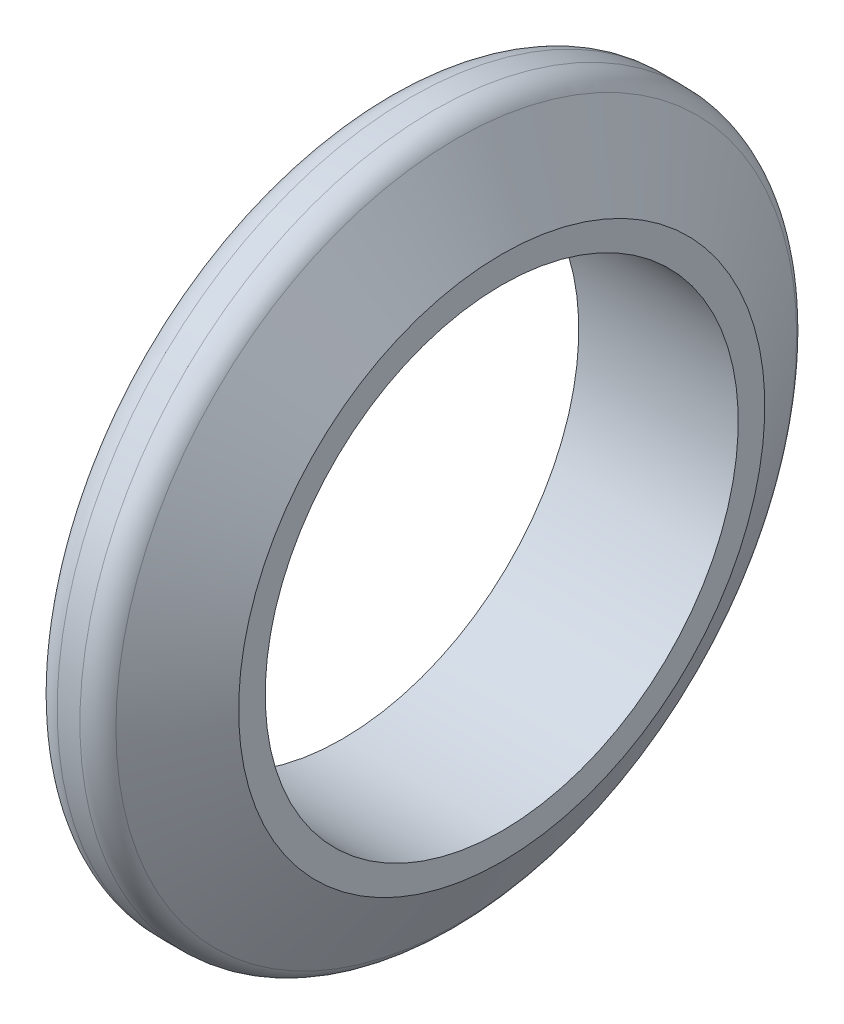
SolidWorks part; units mm, degrees
ref_plane "Front" through (0, 0, 0) normal (0, 0, 1) x (1, 0, 0)
ref_plane "Top" through (0, 0, 0) normal (0, 1, 0) x (1, 0, 0)
ref_plane "Right" through (0, 0, 0) normal (1, 0, 0) x (0, 0, -1)
sketch "Esquisse1" plane through (0, 0, 0) normal (0, 0, 1) x (1, 0, 0)
  line L0 (-62.6155, 0) -> (54.2158, 0) construction
  line L1 (0, 0) -> (-30, 0)
  line L2 (0, 0) -> (0, 49.5)
  line L3 (-12.8597, 66.5) -> (-17.1403, 66.5)
  line L4 (-30, 0) -> (-30, 49.5)
  line L6 (-21.4499, 64.0351) -> (-30, 49.5)
  line L7 (0, 49.5) -> (-8.5501, 64.0351)
  arc A0 (-17.1403, 66.5) -> (-21.4499, 64.0351) centre (-17.1403, 61.5) ccw
  arc A1 (-8.5501, 64.0351) -> (-12.8597, 66.5) centre (-12.8597, 61.5) ccw
  point P7 (-20, 66.5)
  point P14 (-10, 66.5)
  dimension "D6" = 5
  dimension "D1" = 30
  dimension "D2" = 49.5
  dimension "D3" = 66.5
  dimension "D4" = 10
  dimension "D5" = 10
  dimension "D7" = 49.5
revolve "Base-Révolution" add sketch "Esquisse1" angle 360 about L0
sketch "Esquisse2" plane through (0, 0, 0) normal (1, 0, 0) x (0, 0, -1)
  circle A0 centre (0, 0) radius 44.5
  dimension "D1" = 89
extrude "Enlèv. mat.-Extru.1" cut sketch "Esquisse2" against normal through all
